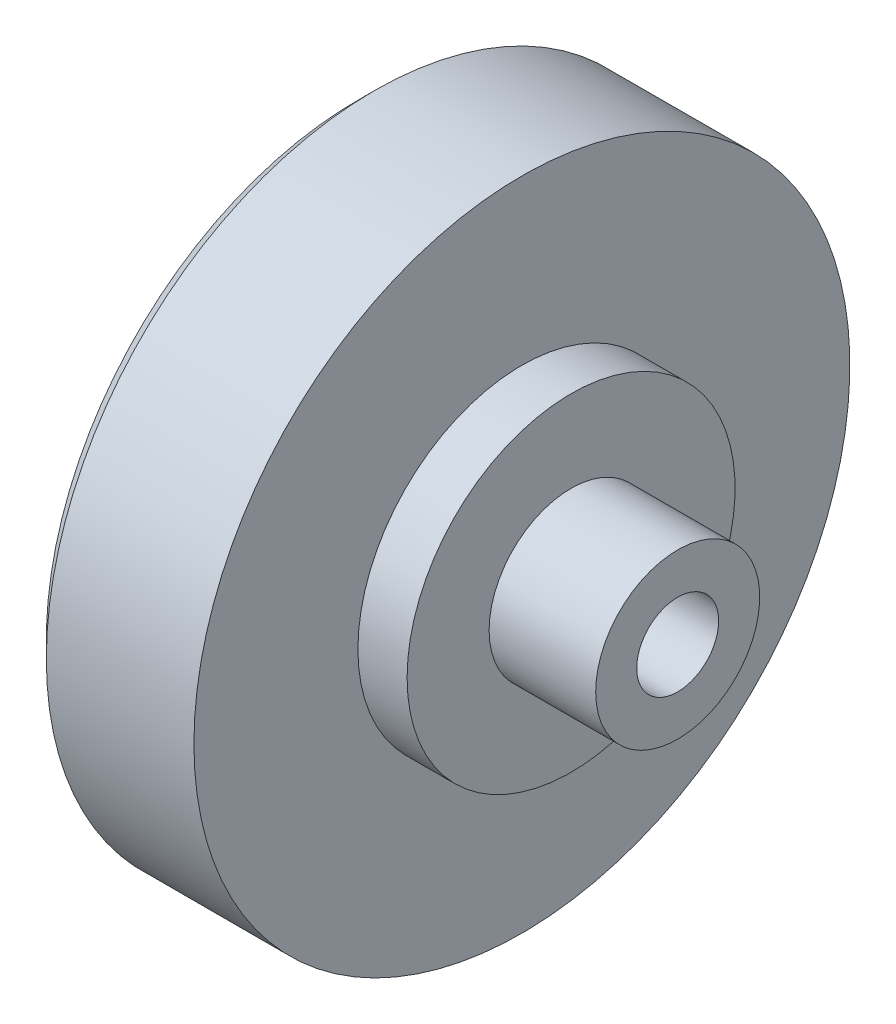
SolidWorks part; units mm, degrees
ref_plane "Front" through (0, 0, 0) normal (0, 0, 1) x (1, 0, 0)
ref_plane "Top" through (0, 0, 0) normal (0, 1, 0) x (1, 0, 0)
ref_plane "Right" through (0, 0, 0) normal (1, 0, 0) x (0, 0, -1)
sketch "Sketch1" plane through (0, 0, 0) normal (0, 1, 0) x (1, 0, 0)
  line L0 (0, 0) -> (19.5, 0)
  line L1 (19.5, 0) -> (19.5, 5)
  line L2 (19.5, 5) -> (13, 5)
  line L3 (13, 5) -> (13, 10)
  line L4 (13, 10) -> (10, 10)
  line L5 (10, 10) -> (10, 20)
  line L6 (10, 20) -> (0, 20)
  line L7 (0, 20) -> (0, 0)
revolve "Revolve1" add sketch "Sketch1" angle 360 about L0
chamfer "Chamfer1" distance 1 angle 45 1 edges at (0, 0, 20)
sketch "Sketch2" plane through (19.5, 0, 0) normal (1, 0, 0) x (0, 0, -1)
  circle A0 centre (0, 0) radius 2.5
extrude "Cut-Extrude1" cut sketch "Sketch2" against normal blind 15
